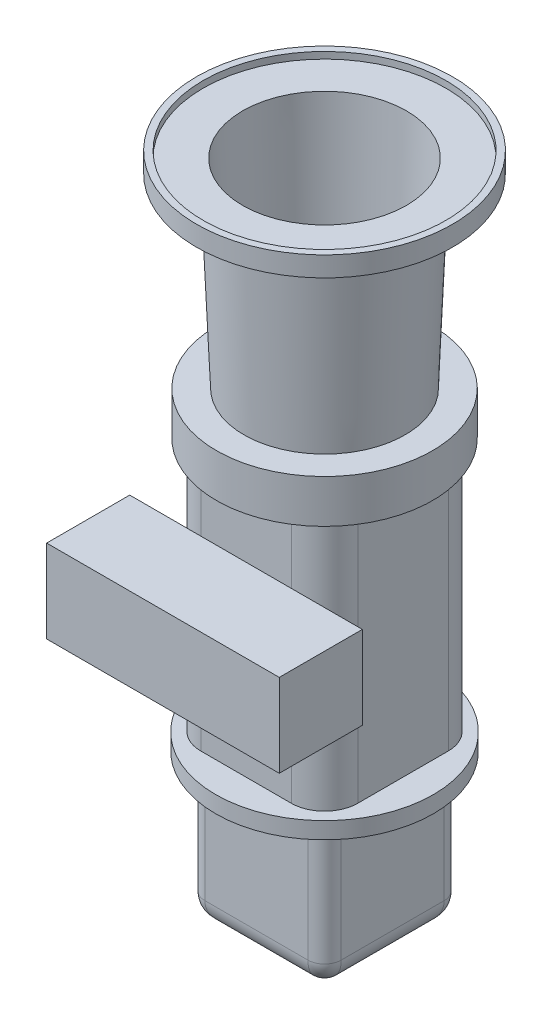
SolidWorks part; units mm, degrees
ref_plane "Plan de face" through (0, 0, 0) normal (0, 0, 1) x (1, 0, 0)
ref_plane "Plan de dessus" through (0, 0, 0) normal (0, 1, 0) x (1, 0, 0)
ref_plane "Plan de droite" through (0, 0, 0) normal (1, 0, 0) x (0, 0, -1)
sketch "Esquisse1" plane through (0, 0, 0) normal (0, 0, 1) x (1, 0, 0)
  line L0 (0, 0) -> (0, -150) construction
  line L1 (77, 0) -> (73, 0)
  line L2 (77, 0) -> (77, -12)
  line L3 (77, -12) -> (53, -12)
  line L4 (53, -12) -> (48.5016, -124)
  line L5 (48.5016, -124) -> (65, -124)
  line L6 (65, -124) -> (65, -150)
  line L7 (65, -150) -> (43.4541, -150)
  line L8 (49.3181, -4) -> (43.4541, -150)
  line L9 (73, 0) -> (73, -4)
  line L10 (73, -4) -> (49.3181, -4)
  dimension "D1" = 150
  dimension "D2" = 12
  dimension "D3" = 154
  dimension "D4" = 4
  dimension "D5" = 130
  dimension "D6" = 26
  dimension "D7" = 150
  dimension "D8" = 4
  dimension "D9" = 4
  dimension "D10" = 106
  dimension "D11" = 2.3
revolve "Révolution1" add sketch "Esquisse1" angle 360 about L0
sketch "Esquisse2" plane through (0, -150, 0) normal (0, -1, 0) x (1, 0, 0)
  line L0 (-47.25, 47.25) -> (47.25, -47.25) construction
  line L1 (-27.25, 47.25) -> (27.25, 47.25)
  line L2 (-47.25, 27.25) -> (-47.25, -27.25)
  line L3 (-27.25, -47.25) -> (27.25, -47.25)
  line L4 (47.25, 27.25) -> (47.25, -27.25)
  arc A0 (-27.25, 47.25) -> (-47.25, 27.25) centre (-27.25, 27.25) ccw
  arc A1 (47.25, 27.25) -> (27.25, 47.25) centre (27.25, 27.25) ccw
  arc A2 (47.25, -27.25) -> (27.25, -47.25) centre (27.25, -27.25) cw
  arc A3 (-47.25, -27.25) -> (-27.25, -47.25) centre (-27.25, -27.25) ccw
  point P10 (47.25, 47.25)
  dimension "D2" = 20
  dimension "D1" = 94.5
extrude "Extrusion1" add sketch "Esquisse2" along normal blind 153
sketch "Esquisse3" plane through (0, 0, 47.25) normal (0, 0, 1) x (1, 0, 0)
  line L0 (0, -150) -> (0, -191) construction
  line L1 (-70, -191) -> (70, -191)
  line L2 (-70, -191) -> (-70, -241)
  line L3 (-70, -241) -> (70, -241)
  line L4 (70, -191) -> (70, -241)
  line L5 (27.25, -150) -> (-27.25, -150) construction
  dimension "D1" = 140
  dimension "D2" = 50
  dimension "D3" = 41
extrude "Extrusion2" add sketch "Esquisse3" along normal blind 50
sketch "Esquisse4" plane through (0, -303, 0) normal (0, -1, 0) x (1, 0, 0)
  circle A0 centre (0, 0) radius 65.5
  dimension "D1" = 131
extrude "Extrusion3" add sketch "Esquisse4" along normal blind 10
sketch "Esquisse5" plane through (0, -313, 0) normal (0, -1, 0) x (1, 0, 0)
  line L0 (-41, 41) -> (41, -41) construction
  line L1 (-31, 41) -> (31, 41)
  line L2 (-41, 31) -> (-41, -31)
  line L3 (-31, -41) -> (31, -41)
  line L4 (41, 31) -> (41, -31)
  arc A0 (-31, 41) -> (-41, 31) centre (-31, 31) ccw
  arc A1 (41, 31) -> (31, 41) centre (31, 31) ccw
  arc A2 (31, -41) -> (41, -31) centre (31, -31) ccw
  arc A3 (-41, -31) -> (-31, -41) centre (-31, -31) ccw
  dimension "D1" = 10
  dimension "D2" = 82
extrude "Extrusion4" add sketch "Esquisse5" along normal blind 88
fillet "Congé1" radius 15 8 edges at (-38.0711, -401, 38.0711) (0, -401, 41) (38.0711, -401, 38.0711) (41, -401, 0) (38.0711, -401, -38.0711) (0, -401, -41) (-38.0711, -401, -38.0711) (-41, -401, 0)
sketch "Esquisse6" plane through (0, -150, 0) normal (0, 1, 0) x (-1, 0, 0)
  circle A0 centre (0, 0) radius 41.25
  dimension "D1" = 82.5
extrude "Extrusion5" add sketch "Esquisse6" along normal blind 6.8
sketch "Esquisse7" plane through (0, -143.2, 0) normal (0, 1, 0) x (-1, 0, 0)
  circle A0 centre (0, 0) radius 8.25
  dimension "D1" = 16.5
extrude "Extrusion6" add sketch "Esquisse7" along normal blind 24.8
